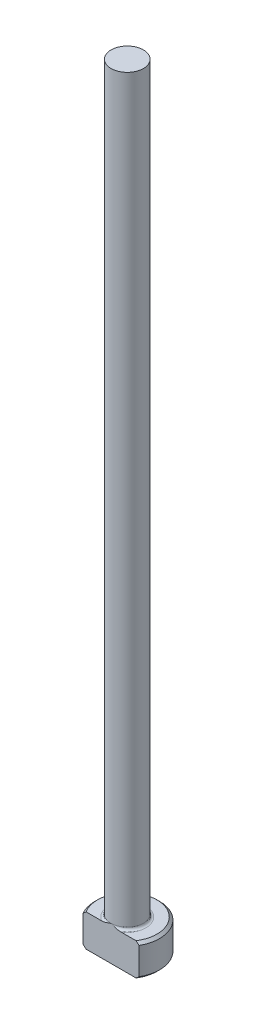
SolidWorks part; units mm, degrees
ref_plane "Front Plane" through (0, 0, 0) normal (0, 0, 1) x (1, 0, 0)
ref_plane "Top Plane" through (0, 0, 0) normal (0, 1, 0) x (1, 0, 0)
ref_plane "Right Plane" through (0, 0, 0) normal (1, 0, 0) x (0, 0, -1)
sketch "Sketch1" plane through (0, 0, 0) normal (0, 0, 1) x (1, 0, 0)
  line L0 (0, 259.9588) -> (0, -15.1925) construction
  line L1 (0, 0) -> (-3.175, 0)
  line L2 (-3.175, 0) -> (-3.175, 3.175)
  line L3 (-3.175, 3.175) -> (-1.5875, 3.175)
  line L4 (-1.5875, 3.175) -> (-1.5875, 76.2)
  line L5 (-1.5875, 76.2) -> (0, 76.2)
  line L6 (0, 76.2) -> (0, 0)
  dimension "L" = 76.2
  dimension "H" = 6.35
  dimension "T" = 3.175
  dimension "D" = 3.175
revolve "Revolve1" add sketch "Sketch1" angle 360 about L0
chamfer "Chamfer1" distance 0.254 angle 45 2 edges at (0, 3.175, 3.175) (0, 0, 3.175)
fillet "Fillet1" radius 0.254 1 edges at (0, 3.175, 1.5875)
sketch "Sketch2" plane through (0, 0, 0) normal (0, 1, 0) x (1, 0, 0)
  line L0 (-2.7496, -1.5875) -> (2.7496, -1.5875)
  circle A0 centre (0, 0) radius 3.175 construction
  arc A1 (-2.7496, -1.5875) -> (2.7496, -1.5875) centre (0, 0) ccw
  circle A3 centre (0, 0) radius 1.5875 construction
  dimension "D1" = 0
extrude "Key" cut sketch "Sketch2" along normal through all
sketch "Pocket Sketch" plane through (0, 0, 0) normal (0, 0, 1) x (1, 0, 0)
  line L0 (-3.5719, 0) -> (-3.5719, 3.2004)
  line L1 (-3.5719, 3.2004) -> (-2.5479, 3.2004)
  line L2 (-1.7859, 3.9624) -> (-1.7859, 22.225)
  line L3 (-1.7859, 22.225) -> (0, 22.225)
  line L4 (0, 22.225) -> (0, 0)
  line L5 (0, 0) -> (-3.5719, 0)
  line L6 (0, 12.6104) -> (0, -2.4989) construction
  line L7 (-3.175, 2.921) -> (-3.175, 0.254) construction
  line L8 (2.921, 3.175) -> (-2.921, 3.175) construction
  line L9 (-1.5875, 76.2) -> (-1.5875, 3.429) construction
  line L10 (-2.5479, 3.2004) -> (-1.7859, 3.9624)
  point P3 (-1.7859, 3.2004)
  dimension "D1" = 7.1437
  dimension "D2" = 0.3969
  dimension "D3" = 0.0254
  dimension "D4" = 0.1984
  dimension "D5" = 3.5719
  dimension "D6" = 22.225
